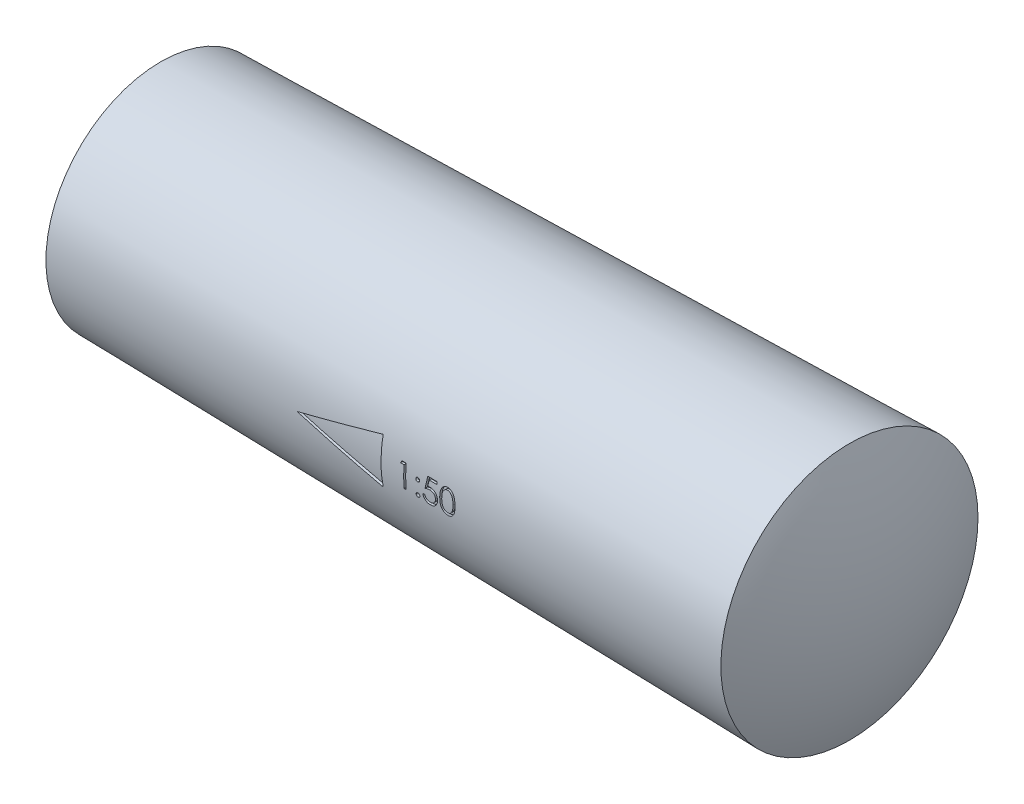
SolidWorks part; units mm, degrees
ref_plane "Front Plane" through (0, 0, 0) normal (0, 0, 1) x (1, 0, 0)
ref_plane "Top Plane" through (0, 0, 0) normal (0, 1, 0) x (1, 0, 0)
ref_plane "Right Plane" through (0, 0, 0) normal (1, 0, 0) x (0, 0, -1)
sketch "Sketch1" plane through (0, 0, 0) normal (1, 0, 0) x (0, 0, -1)
  circle A0 centre (0, 0) radius 5
  dimension "D1" = 10
extrude "Extrude1" add sketch "Sketch1" along normal mid plane 30
draft "Draft1" type of draft neutral plane draft angle 1.146 faces to draft 1 parameters "D1"=1.146
sketch "Sketch2" plane through (0, 0, 0) normal (0, 0, 1) x (1, 0, 0)
  line L0 (-15, 0) -> (-15, 5)
  line L1 (-15, 5) -> (-15, -5) construction
  line L2 (-15, 0) -> (-16.2, 0)
  line L3 (-16.2, 0) -> (-16.2, -5.3) construction
  line L4 (15, 0) -> (15, 5.6)
  line L5 (15, -5.6) -> (15, 5.6) construction
  line L6 (15, 0) -> (16.2, 0)
  line L7 (16.2, 0) -> (16.2, -5.3) construction
  line L8 (-15, -5) -> (15, -5.6) construction
  arc A0 (-16.2, 0) -> (-15, 5) centre (-5.1833, 0) cw
  arc A1 (16.2, 0) -> (15, 5.6) centre (2.5332, 0) ccw
  point P14 (0, -5.3)
revolve "Revolve1" add sketch "Sketch2" angle 360 about L2
sketch "Sketch5" plane through (0, 0, 0) normal (0, 0, 1) x (1, 0, 0)
  line L0 (0, 5.3) -> (0, -5.3) construction
  line L1 (15, 5.6) -> (-15, 5) construction
  line L2 (-15, -5) -> (15, -5.6) construction
ref_plane "Plane2" through (0, 0, 0) normal (-0.02, 0, 0.9998) x (0.9998, 0, 0.02)
sketch "Sketch6" plane through (0, 0, 0) normal (-0.02, 0, 0.9998) x (0.9998, 0, 0.02)
  line L0 (0, 0) -> (0, 1)
  line L1 (0, 5.3) -> (0, -5.3) construction
  line L2 (0, 1) -> (-3.7321, 0)
  line L3 (-3.7321, 0) -> (0, -1)
  line L4 (0, -1) -> (0, 0)
  line L5 (0, -0.5) -> (4, -0.5) construction
  text T0 "1:50" font "Century Gothic" height 1
  dimension "D1" = 2
  dimension "D2" = 30
  dimension "D3" = 4
wrap "Wrap2" sketch "Sketch6" wrap type deboss source sketch "Sketch6" thickness 0.1 parameters "D1"=0.1
equation "\"D2@Sketch2\" = \"D1@Sketch2\""
